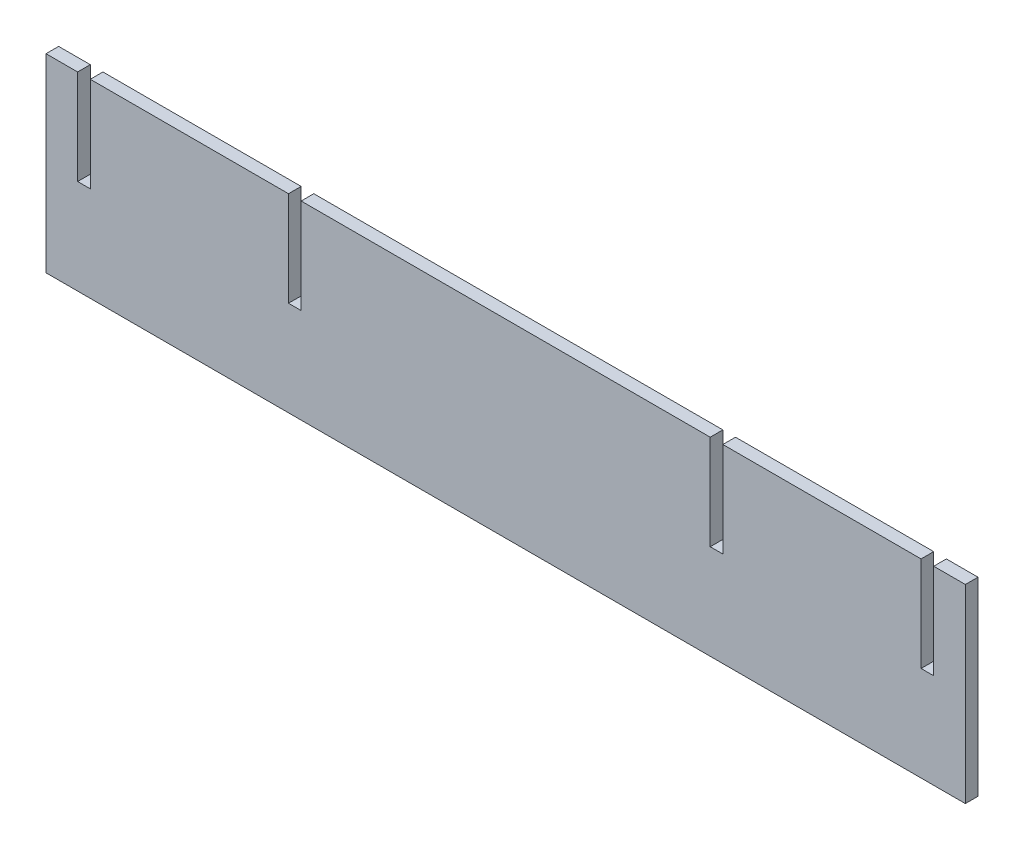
SolidWorks part; units mm, degrees
ref_plane "Alzado" through (0, 0, 0) normal (1, 0, 0) x (0, 1, 0)
ref_plane "Planta" through (0, 0, 0) normal (0, 0, 1) x (0, 1, 0)
ref_plane "Vista lateral" through (0, 0, 0) normal (0, 1, 0) x (-1, 0, 0)
sketch "Sketch3" plane through (0, 0, 0) normal (0, 0, 1) x (0, 1, 0)
  line L0 (90, -194) -> (90, -206)
  line L1 (-90, 436) -> (90, 436)
  line L2 (-90, 436) -> (-90, -436)
  line L3 (-90, -436) -> (90, -436)
  line L4 (90, 436) -> (90, -436)
  line L5 (-90, 436) -> (90, -436) construction
  line L6 (-90, -436) -> (90, 436) construction
  line L7 (90, -394) -> (0, -394)
  line L8 (90, -394) -> (90, -406)
  line L9 (90, -406) -> (0, -406)
  line L10 (0, -394) -> (0, -406)
  line L11 (90, -194) -> (0, -194)
  line L12 (0, -194) -> (0, -206)
  line L13 (90, -206) -> (0, -206)
  line L14 (90, -394) -> (90, -194) construction
  line L15 (90, 6) -> (90, -6) construction
  line L16 (90, 6) -> (0, 6) construction
  line L17 (0, 6) -> (0, -6) construction
  line L18 (90, -6) -> (0, -6) construction
  line L19 (90, 206) -> (90, 194)
  line L20 (90, 206) -> (0, 206)
  line L21 (0, 206) -> (0, 194)
  line L22 (90, 194) -> (0, 194)
  line L23 (90, 406) -> (90, 394)
  line L24 (90, 406) -> (0, 406)
  line L25 (0, 406) -> (0, 394)
  line L26 (90, 394) -> (0, 394)
  point P0 (0, 0)
extrude "Boss-Extrude1" add sketch "Sketch3" along normal blind 12
equation "\"L\"=180"
equation "\"D1@Sketch3\"=\"L\""
equation "\"W\"=12"
equation "\"D3@Sketch3\"=\"W\""
equation "\"D4@Sketch3\"=\"L\"/2"
equation "\"H\"=1700"
equation "\"D2@Sketch3\" = ( ( \"K\" * ( \"N\" - 1 ) ) + ( \"B\" * 2 ) ) + \"W\""
equation "\"B\"=30"
equation "\"D5@Sketch3\"=\"B\""
equation "\"K\"=200"
equation "\"D7@Sketch3\"=\"K\""
equation "\"D6@Sketch3\"=\"N\""
equation "\"N\"=5"
